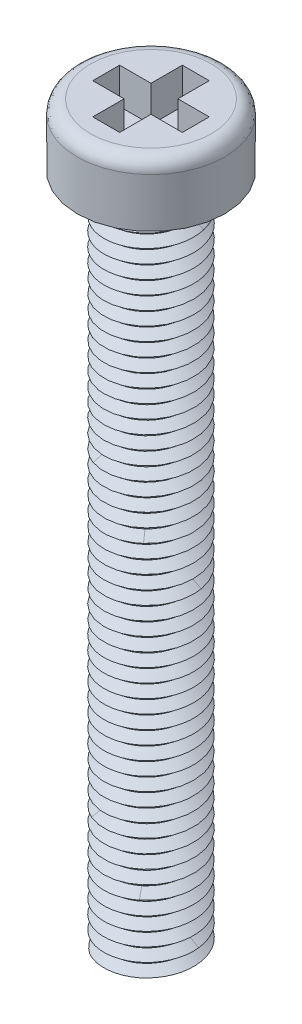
SolidWorks part; units mm, degrees
ref_plane "Front Plane" through (0, 0, 0) normal (0, 0, 1) x (1, 0, 0)
ref_plane "Top Plane" through (0, 0, 0) normal (0, 1, 0) x (1, 0, 0)
ref_plane "Right Plane" through (0, 0, 0) normal (1, 0, 0) x (0, 0, -1)
imported_body "Imported3"
ref_plane "Plane1" through (0, 7.5, 0) normal (0, -1, 0) x (1, 0, 0)
sketch "Sketch1" plane through (0, 7.5, 0) normal (0, -1, 0) x (1, 0, 0)
  circle A0 centre (0, 0) radius 1.65
extrude "Boss-Extrude1" add sketch "Sketch1" against normal blind 1.4
sketch "Sketch2" plane through (0, 8.9, 0) normal (0, 1, 0) x (-1, 0, 0)
  line L0 (-1, 0.3) -> (-1, -0.3)
  line L1 (-1, -0.3) -> (-0.3, -0.3)
  line L2 (-0.3, -0.3) -> (-0.3, -1)
  line L3 (-0.3, -1) -> (0.3, -1)
  line L4 (0.3, -1) -> (0.3, -0.3)
  line L5 (0.3, -0.3) -> (1, -0.3)
  line L6 (1, -0.3) -> (1, 0.3)
  line L7 (1, 0.3) -> (0.3, 0.3)
  line L8 (0.3, 0.3) -> (0.3, 1)
  line L9 (0.3, 1) -> (-0.3, 1)
  line L10 (-0.3, 1) -> (-0.3, 0.3)
  line L11 (-0.3, 0.3) -> (-1, 0.3)
extrude "Cut-Extrude1" cut sketch "Sketch2" against normal blind 0.8
fillet "Fillet1" radius 0.3 1 edges at (0, 8.9, 1.65)
